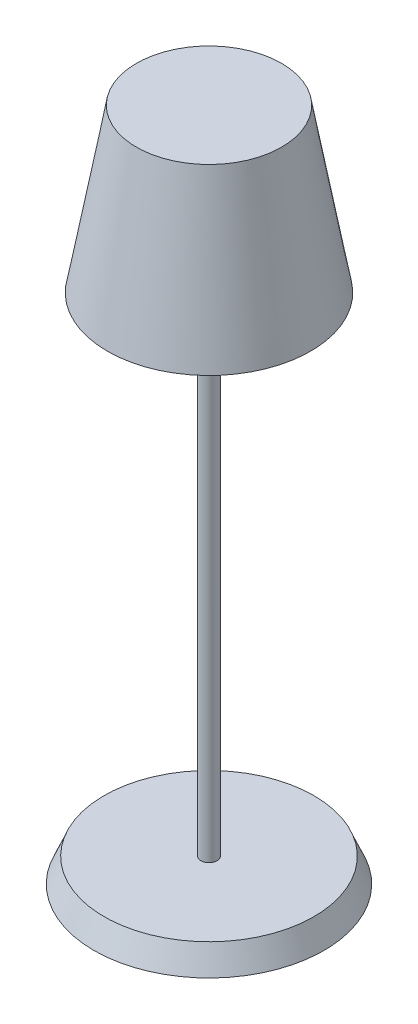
SolidWorks part; units mm, degrees
ref_plane "Alzado" through (0, 0, 0) normal (0, 0, 1) x (1, 0, 0)
ref_plane "Planta" through (0, 0, 0) normal (0, 1, 0) x (1, 0, 0)
ref_plane "Vista lateral" through (0, 0, 0) normal (1, 0, 0) x (0, 0, -1)
sketch "Croquis1" plane through (0, 0, 0) normal (0, 0, 1) x (1, 0, 0)
  line L0 (0, 0) -> (0, 417.9467) construction
  line L1 (0, 417.9467) -> (40, 417.9467)
  line L2 (0, 0) -> (0, 15) construction
  line L3 (0, 0) -> (71.2968, 0)
  line L4 (0, 15) -> (65, 15)
  line L5 (65, 15) -> (71.2968, 0)
  line L6 (0, 15) -> (5, 15)
  line L7 (5, 15) -> (5, 345)
  line L8 (40, 417.9467) -> (5, 345)
  line L9 (5, 345) -> (0, 345)
  line L10 (0, 417.9467) -> (0, 0)
  point P3 (5, 325)
  dimension "D1" = 15
  dimension "D2" = 65
  dimension "D3" = 67.228
  dimension "D4" = 330
  dimension "D5" = 10
  dimension "D6" = 40
  dimension "D7" = 115.632
revolve "Revolución1" add sketch "Croquis1" angle 360 about L0
sketch "Croquis3" plane through (0, 0, 0) normal (0, 0, 1) x (1, 0, 0)
  line L1 (44.0157, 417.7704) -> (62.0157, 317.2644)
  line L4 (45, 417.9467) -> (63, 317.4407)
  line L5 (45, 417.9467) -> (44.0157, 417.7704)
  line L6 (63, 317.4407) -> (62.0157, 317.2644)
  line L7 (45, 417.9467) -> (0, 417.9467)
  line L8 (40, 417.9467) -> (-40, 417.9467) construction
  line L9 (44.0157, 417.7704) -> (0, 417.7704)
  line L10 (0, 417.7704) -> (0, 417.9467)
  dimension "D1" = 1
revolve "Revolución3" add sketch "Croquis3" angle 360 about L10
sketch "Croquis4" plane through (0, 417.9467, 0) normal (0, 1, 0) x (1, 0, 0)
  circle A0 centre (0, 0) radius 45
extrude "Saliente-Extruir2" add sketch "Croquis4" against normal blind 1
